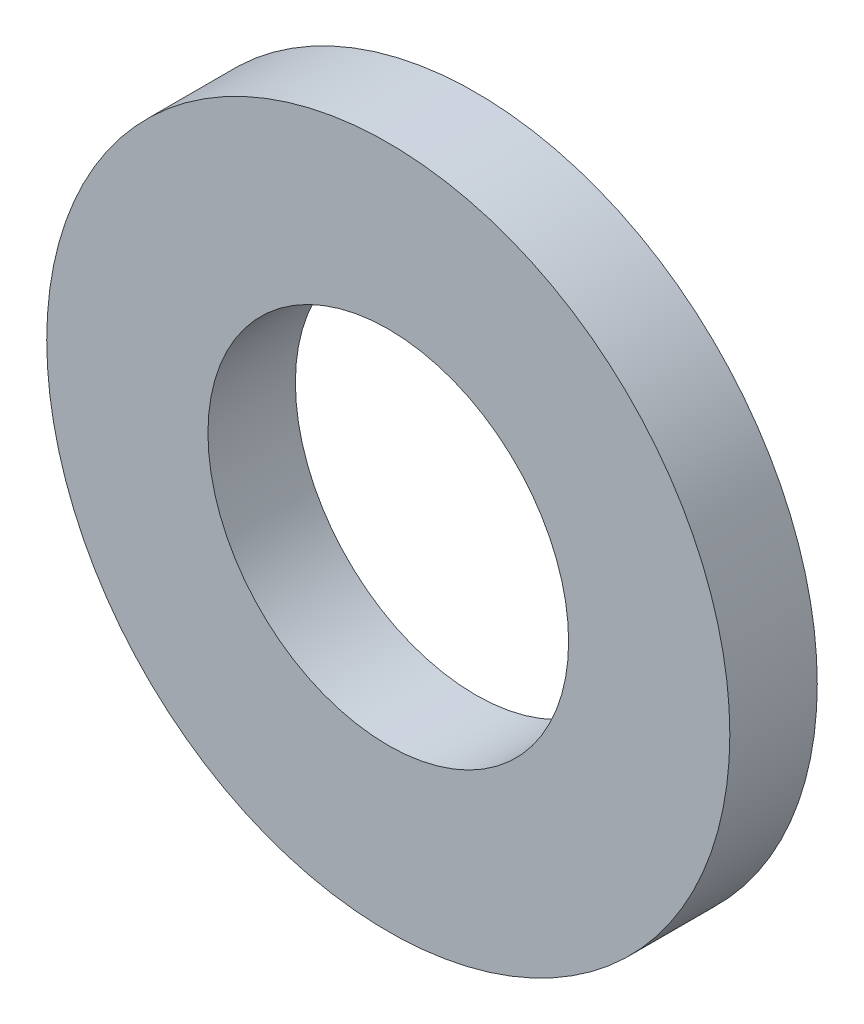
SolidWorks part; units mm, degrees
ref_plane "Front Plane" through (0, 0, 0) normal (0, 0, 1) x (1, 0, 0)
ref_plane "Top Plane" through (0, 0, 0) normal (0, 1, 0) x (1, 0, 0)
ref_plane "Right Plane" through (0, 0, 0) normal (1, 0, 0) x (0, 0, -1)
other "Configuration Table"
sketch "BodySke" plane through (0, 0, 0) normal (0, 1, 0) x (1, 0, 0)
  line L0 (0, 0) -> (0, 7.8986) construction
  line L2 (3.3, 1.6) -> (6.25, 1.6)
  line L3 (3.3, 1.6) -> (3.3, 0)
  line L4 (3.3, 0) -> (6.25, 0)
  line L5 (6.25, 1.6) -> (6.25, 0)
  dimension "Inner_dia" = 6.6
  dimension "Outer_dia" = 12.5
  dimension "Thickness" = 1.6
revolve "BaseBody" add sketch "BodySke" angle 360 about L0
